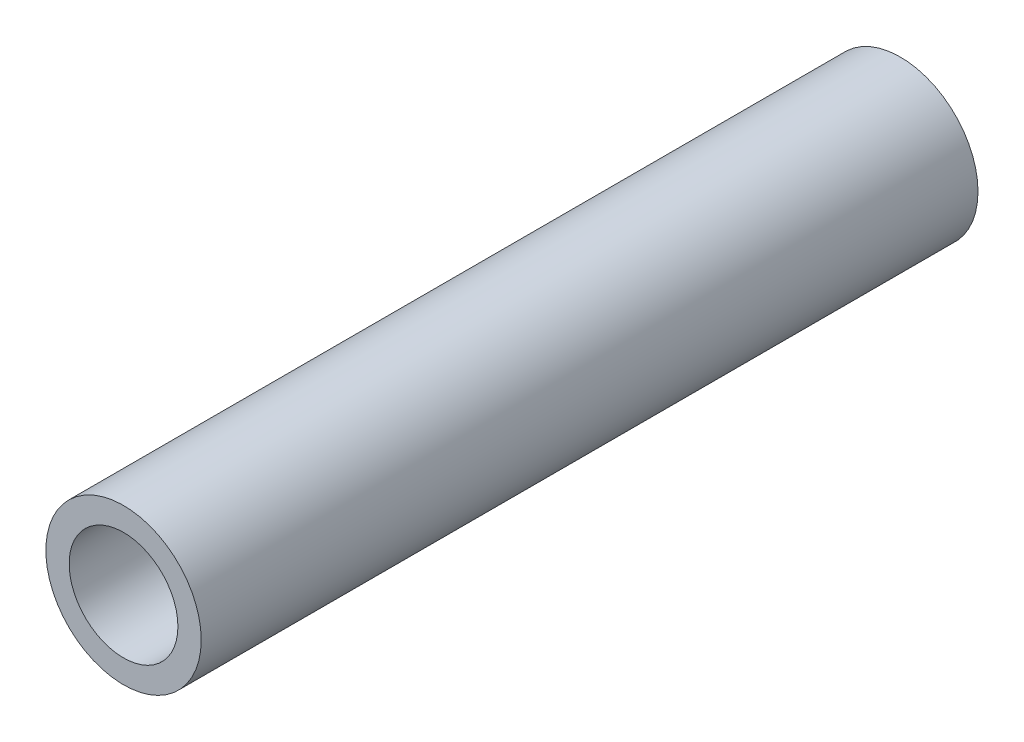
SolidWorks part; units mm, degrees
ref_plane "Ebene vorne" through (0, 0, 0) normal (0, 0, 1) x (1, 0, 0)
ref_plane "Ebene oben" through (0, 0, 0) normal (0, 1, 0) x (1, 0, 0)
ref_plane "Ebene rechts" through (0, 0, 0) normal (1, 0, 0) x (0, 0, -1)
sketch "RohrSkizze" plane through (0, 0, 0) normal (0, 0, 1) x (1, 0, 0)
  circle A0 centre (0, 0) radius 3.5
  circle A1 centre (0, 0) radius 5
  dimension "InnenDurchmesser" = 7
  dimension "AußenDurchmesser" = 10
extrude "Lineare Austragung" add sketch "RohrSkizze" along normal blind 50
sketch "FilterSkizze" plane through (0, 0, 0) normal (0, 0, 1) x (1, 0, 0)
  circle A0 centre (0, 0) radius 5 construction
  dimension "NennDurchmesser" = 10
